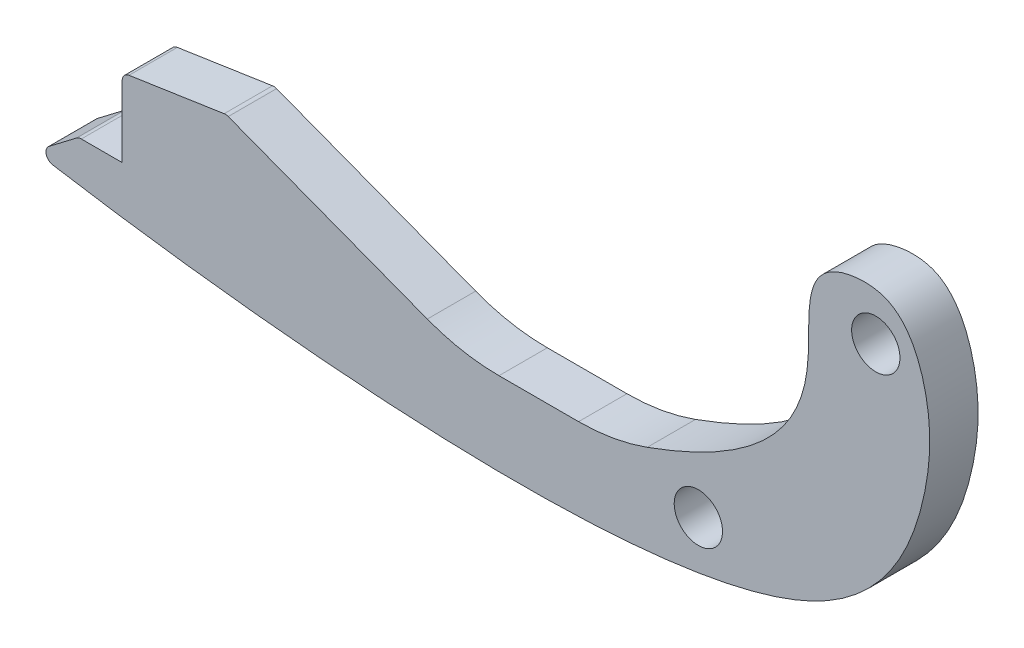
SolidWorks part; units mm, degrees
ref_plane "Front Plane" through (0, 0, 0) normal (0, 0, 1) x (1, 0, 0)
ref_plane "Top Plane" through (0, 0, 0) normal (0, 1, 0) x (1, 0, 0)
ref_plane "Right Plane" through (0, 0, 0) normal (1, 0, 0) x (0, 0, -1)
sketch "Sketch1" plane through (0, 0, 0) normal (0, 0, 1) x (1, 0, 0)
  line L0 (-20.6855, 19.5851) -> (-5.8262, 13.9238)
  line L1 (-5.8262, 13.9238) -> (3.5759, 13.9238)
  line L3 (-5.8262, 13.9238) -> (-45.3785, 28.993) construction
  line L4 (-32.7758, 11.5616) -> (-29.9966, 13.6816)
  line L5 (-29.9966, 13.6816) -> (-27.2483, 13.6816)
  line L6 (-27.2483, 13.6816) -> (-27.2483, 18.5979)
  line L7 (-27.2483, 18.5979) -> (-20.6855, 19.5851)
  circle A0 centre (20.2678, 27.535) radius 1.524
  circle A1 centre (9.0804, 12.4623) radius 1.524
  spline S1 degree 3 poles (3.5759, 13.9238) (12.5367, 16.6791) (17.3819, 21.9915) (15.3085, 30.357) (21.917, 30.8011) (23.942, 25.96) (23.4062, 18.7841) (15.6272, 4.0909) (-25.7015, 10.2878) (-32.7758, 11.5616) knots 0 0 0 0 0.198346 0.310371 0.342564 0.40233 0.468249 0.610249 1 1 1 1
  dimension "D1" = 3.048
  dimension "D2" = 15.9012
extrude "Boss-Extrude1" add sketch "Sketch1" along normal blind 3.048
fillet "Fillet1" radius 12.7 2 edges at (-5.8262, 13.9238, 1.524) (3.5759, 13.9238, 1.524)
fillet "Fillet2" radius 0.508 4 edges at (-29.9966, 13.6816, 1.524) (-27.2483, 18.5979, 1.524) (-32.7758, 11.5616, 1.524) (-20.6855, 19.5851, 1.524)
